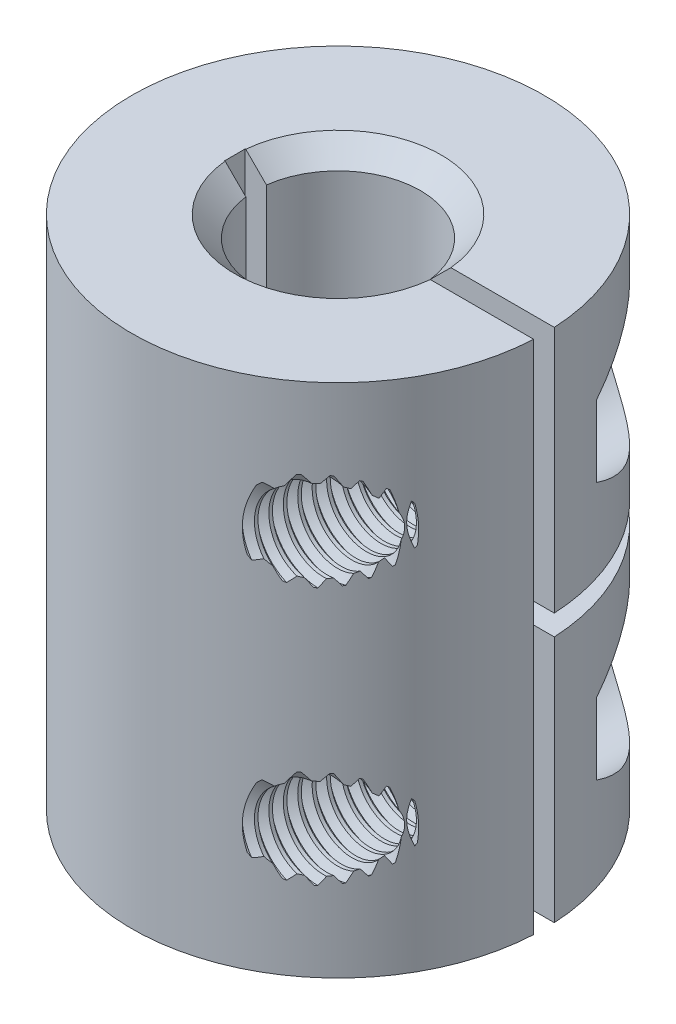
SolidWorks part; units mm, degrees
ref_plane "Front Plane" through (0, 0, 0) normal (0, 0, 1) x (1, 0, 0)
ref_plane "Top Plane" through (0, 0, 0) normal (0, 1, 0) x (1, 0, 0)
ref_plane "Right Plane" through (0, 0, 0) normal (1, 0, 0) x (0, 0, -1)
sketch "Sketch1" plane through (0, 0, 0) normal (0, 0, 1) x (1, 0, 0)
  line L0 (0, 1.4546) -> (0, 12.5) construction
  line L1 (2.5, 0) -> (10, 0)
  line L2 (0, 12.5) -> (0, 25) construction
  line L3 (4, 25) -> (10, 25)
  line L4 (10, 0) -> (10, 25)
  line L5 (0, 0) -> (2.5, 0) construction
  line L6 (0, 0) -> (0, 1.4546) construction
  line L7 (0, 12.5) -> (2.5, 12.5) construction
  line L8 (2.5, 0) -> (2.5, 12.5)
  line L9 (0, 25) -> (4, 25) construction
  line L10 (0, 25) -> (0, 12.5) construction
  line L11 (2.5, 12.5) -> (4, 12.5)
  line L12 (4, 25) -> (4, 12.5)
  line L13 (0, 1.4546) -> (0, 12.5) construction
  line L14 (0, 0) -> (2.5, 0) construction
  line L15 (0, 12.5) -> (2.5, 12.5) construction
  line L16 (0, 25) -> (4, 25) construction
  dimension "D1" = 10
  dimension "D2" = 2.5
  dimension "D3" = 4
  dimension "D4" = 12.5
  dimension "D5" = 12.5
revolve "Revolve1" add sketch "Sketch1" angle 360 about L0
sketch "Sketch2" plane through (0, 25, 0) normal (0, 1, 0) x (1, 0, 0)
  line L0 (-5, -0.5) -> (-5, 0.5)
  line L1 (-10, -0.5) -> (10, -0.5)
  line L2 (-10, -0.5) -> (-10, 0.5)
  line L3 (-10, 0.5) -> (10, 0.5)
  line L4 (10, -0.5) -> (10, 0.5)
  line L5 (-10, -0.5) -> (10, 0.5) construction
  line L6 (-10, 0.5) -> (10, -0.5) construction
  circle A0 centre (0, 0) radius 10 construction
  circle A1 centre (0, 0) radius 10 construction
  point P0 (0, 0)
  dimension "D1" = 5
  dimension "D2" = 1
extrude "Cut-Extrude1" cut sketch "Sketch2" against normal through all contours L3 L0 L1 M7 | L3 L1 M7 | L3 L1 M7 M8
sketch "Sketch3" plane through (0, 0, -0.5) normal (0, 0, 1) x (1, 0, 0)
  line L0 (3.9686, 12.5) -> (-3.9686, 12.5) construction
  line L1 (3.9686, 12.5) -> (-3.9686, 12.5) construction
  line L3 (10, 12) -> (-10, 12)
  line L4 (10, 12) -> (10, 13)
  line L5 (10, 13) -> (-10, 13)
  line L6 (-10, 12) -> (-10, 13)
  line L7 (10, 12) -> (-10, 13) construction
  line L8 (10, 13) -> (-10, 12) construction
  point P2 (0, 12.5)
  dimension "D1" = 1
  dimension "D2" = 20
extrude "Cut-Extrude2" cut sketch "Sketch3" against normal through all
ref_plane "Plane1" through (0, 0, -3) normal (0, 0, 1) x (1, 0, 0)
sketch "Sketch4" plane through (0, 0, -3) normal (0, 0, 1) x (1, 0, 0)
  line L0 (9.9875, 13) -> (3.9686, 13) construction
  line L1 (2.4495, 12) -> (9.9875, 12) construction
  line L2 (9.9875, 13) -> (3.9686, 13) construction
  line L3 (2.4495, 12) -> (9.9875, 12) construction
  line L4 (9.9875, 12) -> (9.9875, 13) construction
  line L5 (9.9875, 12.5) -> (-11.6286, 12.5) construction
  circle A0 centre (6.5, 6.25) radius 3.5
  circle A1 centre (6.5, 18.75) radius 3.5
  point P2 (0, 0)
  dimension "D1" = 7
  dimension "D3" = 6.25
  dimension "D2" = 6.5
extrude "Cut-Extrude3" cut sketch "Sketch4" against normal through all
sketch "Sketch5" plane through (0, 0, -3) normal (0, 0, -1) x (-1, 0, 0)
  arc A0 (-9.5394, 4.5145) -> (-9.5394, 7.9855) centre (-6.5, 6.25) ccw construction
  arc A1 (-9.5394, 17.0145) -> (-9.5394, 20.4855) centre (-6.5, 18.75) ccw construction
  arc A2 (-9.5394, 4.5145) -> (-9.5394, 7.9855) centre (-6.5, 6.25) ccw construction
  arc A3 (-9.5394, 17.0145) -> (-9.5394, 20.4855) centre (-6.5, 18.75) ccw construction
  circle A4 centre (-6.5, 18.75) radius 2
  circle A5 centre (-6.5, 6.25) radius 2
  dimension "D1" = 4
extrude "Cut-Extrude4" cut sketch "Sketch5" against normal through all
chamfer "Chamfer1" distance 1 angle 45 4 edges at (0, 25, -4) (0, 25, 4) (0, 0, 2.5) (0, 0, -2.5)
thread "Thread1" pitch 0.7 start angle 0, offset 0, length 10, pitch 0.7, diameter 4
ref_plane "Plane2" through (8.5, 18.75, 0.5) normal (0, -1, 0) x (1, 0, 0)
sketch "Thread Profile1" plane through (8.5, 18.75, 0.5) normal (0, -1, 0) x (1, 0, 0)
  line L0 (0, 0) -> (0, 0.7) construction
  line L1 (0, 0) -> (0.3789, 0.2187)
  line L2 (0.3789, 0.2187) -> (0.3789, 0.3062)
  line L3 (0.3789, 0.3062) -> (0, 0.525)
  line L4 (0.3789, 0.2625) -> (0, 0.2625) construction
  line L11 (0, 0) -> (0, 0.525)
  point P2 (0, 0)
  dimension "Pitch" = 0.7
  dimension "Profile_Angle" = 60
  dimension "Profile_Land" = 0.0875
  dimension "Profile_Height" = 0.3789
thread "Thread2" pitch 0.7 start angle 0, offset 0, length 10, pitch 0.7, diameter 4
ref_plane "Plane3" through (8.5, 6.25, 0.5) normal (0, -1, 0) x (1, 0, 0)
sketch "Thread Profile2" plane through (8.5, 6.25, 0.5) normal (0, -1, 0) x (1, 0, 0)
  line L0 (0, 0) -> (0, 0.7) construction
  line L1 (0, 0) -> (0.3789, 0.2187)
  line L2 (0.3789, 0.2187) -> (0.3789, 0.3062)
  line L3 (0.3789, 0.3062) -> (0, 0.525)
  line L4 (0.3789, 0.2625) -> (0, 0.2625) construction
  line L11 (0, 0) -> (0, 0.525)
  point P2 (0, 0)
  dimension "Pitch" = 0.7
  dimension "Profile_Angle" = 60
  dimension "Profile_Land" = 0.0875
  dimension "Profile_Height" = 0.3789
